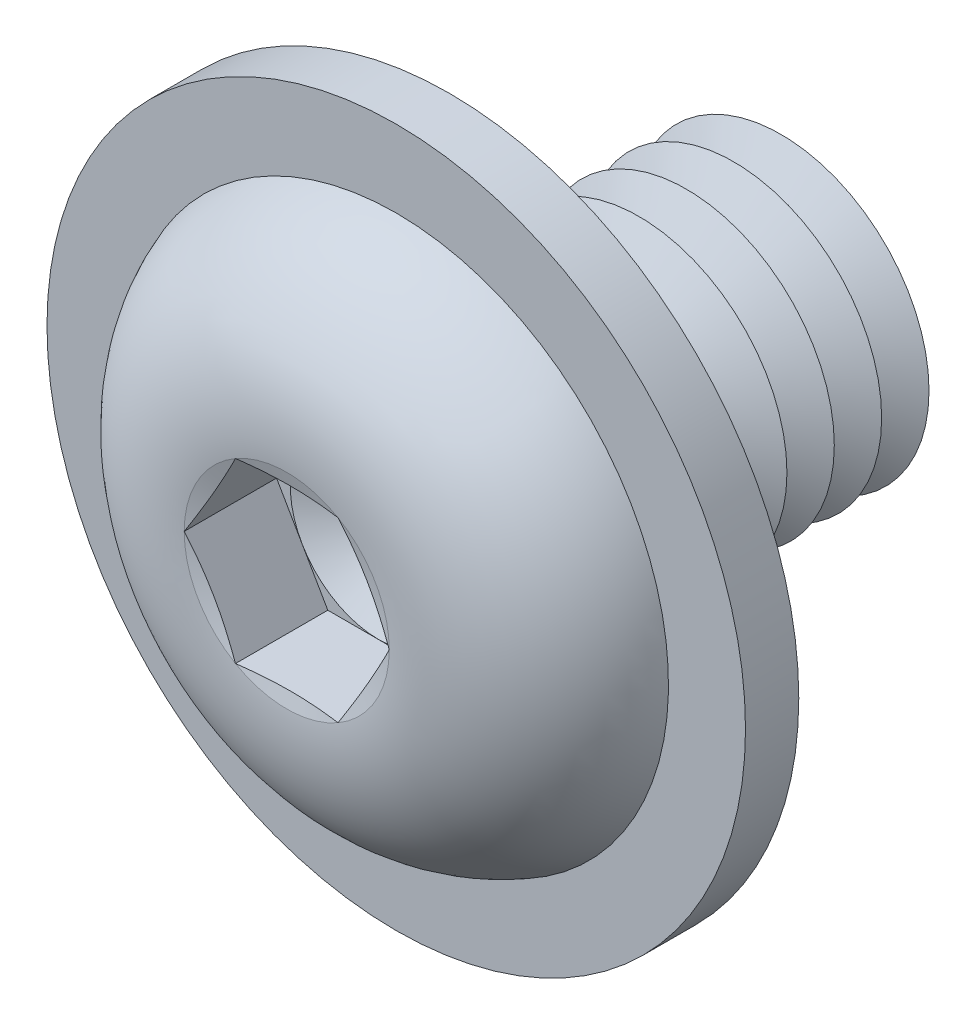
SolidWorks part; units mm, degrees
ref_plane "Front Plane" through (0, 0, 0) normal (0, 0, 1) x (1, 0, 0)
ref_plane "Top Plane" through (0, 0, 0) normal (0, 1, 0) x (1, 0, 0)
ref_plane "Right Plane" through (0, 0, 0) normal (1, 0, 0) x (0, 0, -1)
sketch "Sketch1" plane through (0, 0, 0) normal (1, 0, 0) x (0, 0, -1)
  line L0 (0, 2.5) -> (0, 4.75)
  line L3 (0, 2.5) -> (6, 2.5)
  line L4 (6, 2.5) -> (6, 0)
  line L5 (6, 0) -> (-2.75, 0) construction
  line L6 (-2.75, 0) -> (6, 0)
  line L7 (-2.75, 1.732) -> (-2.75, 0.866) construction
  line L8 (-2.75, 0.866) -> (-2.75, 0)
  line L9 (-2.75, 1.732) -> (-2.5179, 0.866)
  line L10 (-2.5179, 0.866) -> (-2.75, 0.866)
  line L11 (6, 0) -> (22.7481, 0) construction
  line L12 (0, 4.75) -> (-2.75, 4.75) construction
  arc A1 (0, 4.75) -> (-2.75, 1.732) centre (0, 1.9881) ccw
  point P8 (6, 1.25)
  dimension "D1" = 9.5
  dimension "D2" = 5
  dimension "D3" = 2.75
  dimension "D4" = 3.4641
  dimension "D5" = 6
  dimension "D6" = 15
revolve "Revolve1" add sketch "Sketch1" angle 360 about L5
fillet "Fillet1" radius 0.4 1 edges at (-2.5, 0, 0)
sketch "Sketch2" plane through (0, 0, 0) normal (1, 0, 0) x (0, 0, -1)
  line L0 (5.6, 2.5) -> (6.4, 2.5)
  line L1 (6, 2.5) -> (0.4, 2.5) construction
  line L2 (6.4, 2.5) -> (6, 1.8072)
  line L3 (6, -2.5) -> (6, 2.5) construction
  line L4 (6, 1.8072) -> (5.6, 2.5)
  dimension "D1" = 0.8
revolve "Cut-Revolve1" cut sketch "Sketch2" angle 360 about axis through (0, 0, -6) along (0, 0, -1)
pattern_linear "LPattern1" count 7 spacing 0.8 along (0, 0, 1) of "Cut-Revolve1"
sketch "Sketch3" plane through (0, 0, 2.75) normal (0, 0, 1) x (1, 0, 0)
  line L7 (0.866, 1.5) -> (-0.866, 1.5)
  line L8 (-0.866, 1.5) -> (-1.7321, 0)
  line L9 (-1.7321, 0) -> (-0.866, -1.5)
  line L10 (-0.866, -1.5) -> (0.866, -1.5)
  line L11 (0.866, -1.5) -> (1.732, 0)
  line L12 (1.732, 0) -> (0.866, 1.5)
  circle A0 centre (0, 0) radius 1.5 construction
  circle A3 centre (0, 0) radius 1.7321 construction
extrude "Cut-Extrude1" cut sketch "Sketch3" against normal blind 1.56
sketch "Sketch4" plane through (0, 0, 1.19) normal (0, 0, 1) x (1, 0, 0)
  line L1 (0.866, 1.5) -> (-0.866, 1.5) construction
  circle A0 centre (0, 0) radius 1.5
extrude "Cut-Extrude2" cut sketch "Sketch4" against normal through all draft 60
sketch "Sketch5" plane through (0, 0, 0) normal (0, 0, -1) x (-1, 0, 0)
  circle A0 centre (0, 0) radius 5.9
  circle A1 centre (0, 0) radius 2.9
  circle A2 centre (0, 0) radius 2.9 construction
  dimension "D1" = 11.8
extrude "Boss-Extrude1" add sketch "Sketch5" against normal blind 0.9
